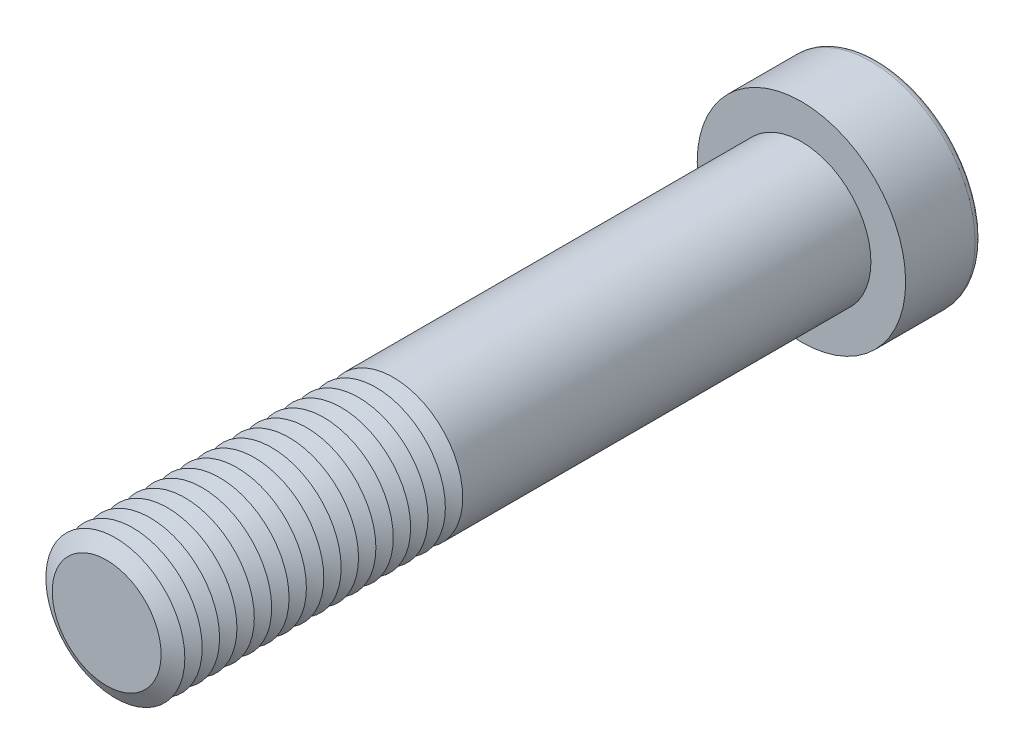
SolidWorks part; units mm, degrees
ref_plane "Front Plane" through (0, 0, 0) normal (0, 0, 1) x (1, 0, 0)
ref_plane "Top Plane" through (0, 0, 0) normal (0, 1, 0) x (1, 0, 0)
ref_plane "Right Plane" through (0, 0, 0) normal (1, 0, 0) x (0, 0, -1)
sketch "Sketch1" plane through (0, 0, 0) normal (0, 0, 1) x (1, 0, 0)
  circle A0 centre (0, 0) radius 10
  dimension "D1" = 20
extrude "Boss-Extrude1" add sketch "Sketch1" along normal blind 100
sketch "Sketch2" plane through (0, 0, 0) normal (0, 0, -1) x (-1, 0, 0)
  circle A0 centre (0, 0) radius 15
  dimension "D1" = 30
extrude "Boss-Extrude2" add sketch "Sketch2" along normal blind 11
sketch "Sketch3" plane through (0, 0, -11) normal (0, 0, -1) x (-1, 0, 0)
  line L1 (-4.0415, 7) -> (-8.0829, 0)
  line L2 (-8.0829, 0) -> (-4.0415, -7)
  line L3 (-4.0415, -7) -> (4.0415, -7)
  line L4 (4.0415, -7) -> (8.0829, 0)
  line L5 (8.0829, 0) -> (4.0415, 7)
  line L6 (4.0415, 7) -> (-4.0415, 7)
  circle A0 centre (0, 0) radius 7 construction
  dimension "D1" = 14
extrude "Cut-Extrude1" cut sketch "Sketch3" against normal blind 10.5
fillet "Fillet1" radius 1 1 edges at (-15, 0, -11)
sketch "Sketch4" plane through (0, 0, -0.5) normal (0, 0, -1) x (-1, 0, 0)
  line L0 (4.0415, -7) -> (8.0829, 0) construction
  circle A0 centre (0, 0) radius 7
extrude "Cut-Extrude2" cut sketch "Sketch4" against normal through all draft 60
sketch "Sketch5" plane through (0, 0, -11) normal (0, 0, -1) x (-1, 0, 0)
  circle A0 centre (0, 0) radius 8.0829
extrude "Cut-Extrude3" cut sketch "Sketch5" against normal through all draft 75
sketch "Sketch7" plane through (0, 0, 0) normal (1, 0, 0) x (0, 0, -1)
  line L25 (-100, 7.8349) -> (-98.75, 10)
  line L26 (-100, 10) -> (-100, -10) construction
  line L27 (-98.75, 10) -> (-101.25, 10)
  line L28 (-101.25, 10) -> (-100, 7.8349)
  line L29 (0, 10) -> (-100, 10) construction
  dimension "D1" = 2.5
revolve "Cut-Revolve1" cut sketch "Sketch7" angle 360 about axis through (0, 0, 100) along (0, 0, -1)
pattern_linear "LPattern1" count 17 spacing 2.5 along (0, 0, -1) of "Cut-Revolve1"
